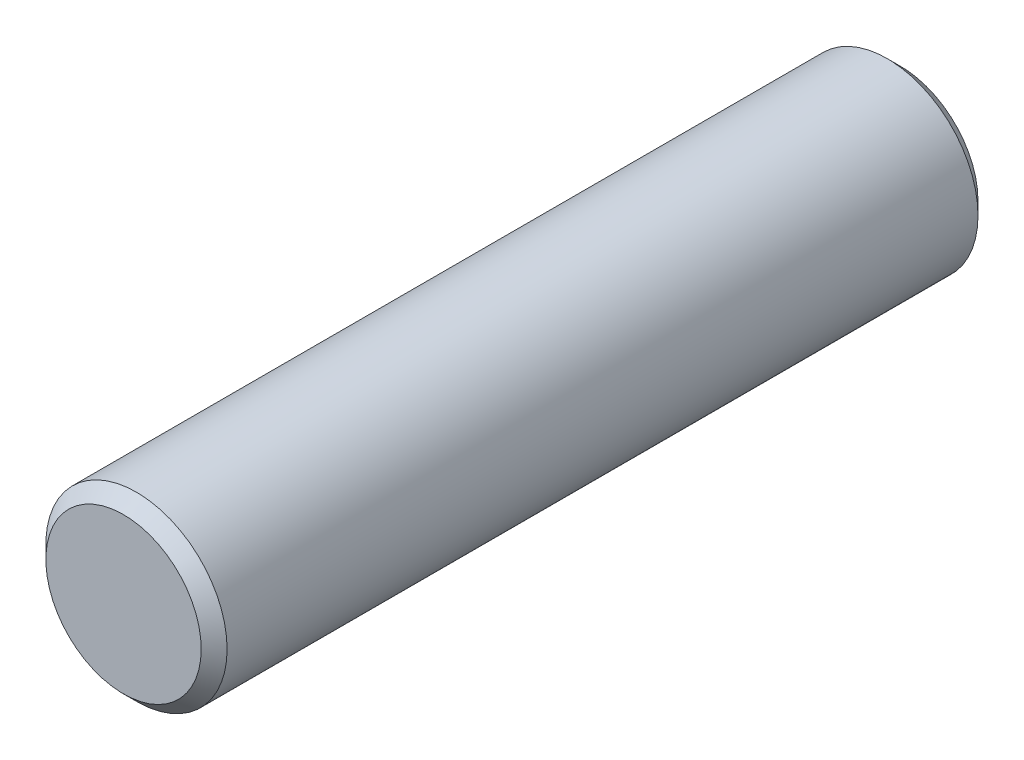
SolidWorks part; units mm, degrees
ref_plane "Face" through (0, 0, 0) normal (0, 0, 1) x (1, 0, 0)
ref_plane "Dessus" through (0, 0, 0) normal (0, 1, 0) x (1, 0, 0)
ref_plane "Droite" through (0, 0, 0) normal (1, 0, 0) x (0, 0, -1)
sketch "Esquisse1" plane through (0, 0, 0) normal (0, 0, 1) x (1, 0, 0)
  circle A0 centre (0, 0) radius 3.5
  dimension "D1" = 7
extrude "Extrusion1" add sketch "Esquisse1" along normal blind 30
chamfer "Chanfrein1" distance 0.5 angle 45 2 edges at (3.5, 0, 0) (3.5, 0, 30)
